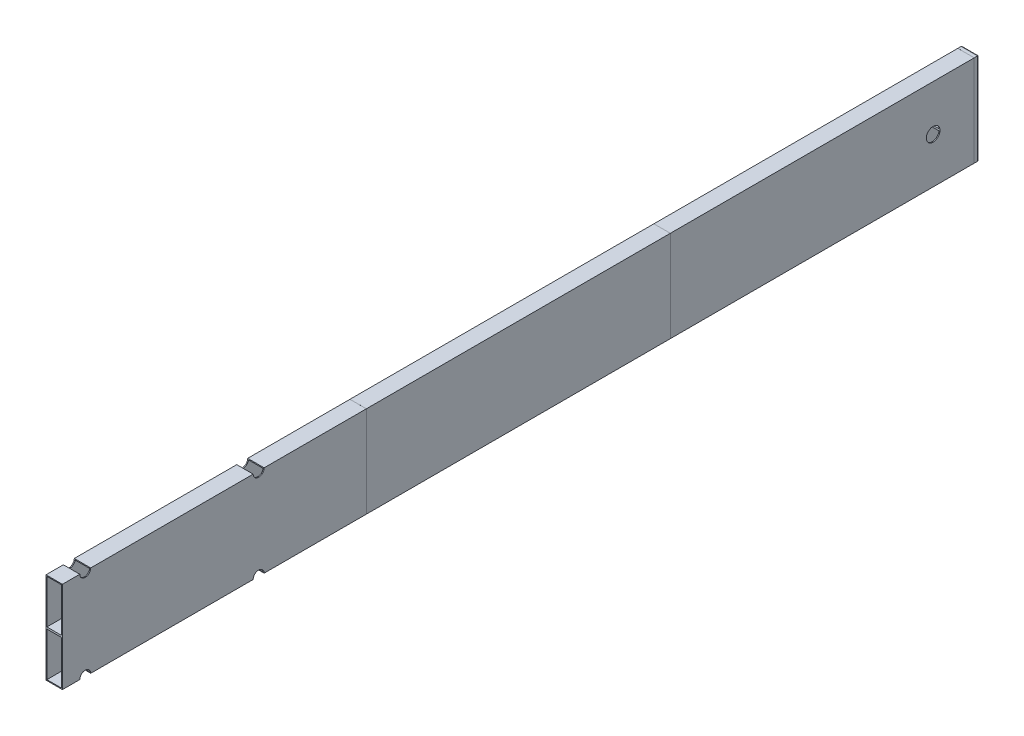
SolidWorks part; units mm, degrees
ref_plane "Plan1" through (0, 0, 0) normal (0, 0, 1) x (1, 0, 0)
ref_plane "Plan2" through (0, 0, 0) normal (0, 1, 0) x (1, 0, 0)
ref_plane "Plan3" through (0, 0, 0) normal (1, 0, 0) x (0, 0, -1)
sketch "Esquisse1" plane through (0, 0, 0) normal (0, 0, 1) x (1, 0, 0)
  line L0 (0, 0) -> (0, 110) construction
  line L1 (-9, 100) -> (9, 100)
  line L2 (-9, 100) -> (-9, 0)
  line L3 (-9, 0) -> (9, 0)
  line L4 (9, 100) -> (9, 0)
  line L5 (-9, 50) -> (30, 50) construction
  line L6 (-8, 49) -> (8, 49)
  line L7 (-8, 99) -> (8, 99)
  line L8 (-8, 99) -> (-8, 51)
  line L9 (-8, 51) -> (8, 51)
  line L10 (8, 99) -> (8, 51)
  line L11 (8, 1) -> (8, 49)
  line L12 (-8, 1) -> (-8, 49)
  line L13 (-8, 1) -> (8, 1)
  point P4 (0, 0)
  dimension "D1" = 100
  dimension "D2" = 18
  dimension "D3" = 16
  dimension "D4" = 48
  dimension "D5" = 1
extrude "Base-Extrusion" add sketch "Esquisse1" against normal blind 333
sketch "Esquisse4" plane through (9, 0, 0) normal (1, 0, 0) x (0, 0, -1)
  line L0 (333, 100) -> (0, 100) construction
  line L1 (333, 0) -> (0, 0) construction
  line L2 (0, 0) -> (0, 100) construction
  circle A0 centre (25, 100) radius 6
  circle A1 centre (215, 100) radius 6
  circle A2 centre (25, 0) radius 6
  circle A3 centre (215, 0) radius 6
  dimension "D1" = 12
  dimension "D2" = 12
  dimension "D3" = 12
  dimension "D4" = 12
  dimension "D6" = 190
  dimension "D5" = 25
extrude "Enlèv. mat.-Extru.1" cut sketch "Esquisse4" against normal through all
sketch "Esquisse7" plane through (0, 0, -333) normal (0, 0, -1) x (-1, 0, 0)
  line L0 (-9, 50) -> (20, 50) construction
  line L1 (-9, 0) -> (-9, 100) construction
  line L2 (0, 0) -> (0, 110) construction
  line L3 (-8, 1) -> (8, 1)
  line L4 (-8, 51) -> (8, 51)
  line L5 (-8, 51) -> (-8, 99)
  line L6 (-8, 99) -> (8, 99)
  line L7 (8, 51) -> (8, 99)
  line L8 (8, 49) -> (8, 1)
  line L9 (-8, 49) -> (8, 49)
  line L10 (-8, 49) -> (-8, 1)
  line L12 (-9.01, 100.01) -> (9.01, 100.01)
  line L13 (-9.01, 100.01) -> (-9.01, -0.01)
  line L14 (-9.01, -0.01) -> (9.01, -0.01)
  line L15 (9.01, 100.01) -> (9.01, -0.01)
  dimension "D1" = 18.02
  dimension "D2" = 100.02
extrude "Boss.-Extru.1" add sketch "Esquisse7" along normal blind 333
sketch "Esquisse8" plane through (0, 0, -666) normal (0, 0, -1) x (-1, 0, 0)
  line L0 (-9.01, 50) -> (20, 50) construction
  line L1 (-9.01, 100.01) -> (-9.01, -0.01) construction
  line L2 (0, 0) -> (0, 110) construction
  line L3 (-8, 1) -> (8, 1)
  line L4 (-8, 51) -> (8, 51)
  line L5 (-8, 51) -> (-8, 99)
  line L6 (-8, 99) -> (8, 99)
  line L7 (8, 51) -> (8, 99)
  line L8 (8, 49) -> (8, 1)
  line L9 (-8, 49) -> (8, 49)
  line L10 (-8, 49) -> (-8, 1)
  line L12 (-9, 100) -> (9, 100)
  line L13 (-9, 100) -> (-9, 0)
  line L14 (-9, 0) -> (9, 0)
  line L15 (9, 100) -> (9, 0)
  dimension "D1" = 18
  dimension "D2" = 100
extrude "Boss.-Extru.2" add sketch "Esquisse8" along normal blind 333
sketch "Esquisse9" plane through (0, 0, -999) normal (0, 0, -1) x (-1, 0, 0)
  line L0 (-9, 50) -> (20, 50) construction
  line L1 (-9.01, 100.01) -> (9.01, 100.01)
  line L2 (-9.01, 100.01) -> (-9.01, -0.01)
  line L3 (-9.01, -0.01) -> (9.01, -0.01)
  line L4 (9.01, 100.01) -> (9.01, -0.01)
  line L5 (-9, 100) -> (-9, 0) construction
  line L6 (0, 0) -> (0, 50) construction
  dimension "D1" = 100.02
  dimension "D2" = 18.02
extrude "Boss.-Extru.3" add sketch "Esquisse9" along normal blind 5
fillet "Congé1" radius 1.5
sketch "Esquisse10" plane through (9.01, 0, 0) normal (1, 0, 0) x (0, 0, -1)
  line L0 (165, 50) -> (999, 50) construction
  line L1 (999, 100.01) -> (999, -0.01) construction
sketch "Esquisse11" plane through (9, 0, 0) normal (1, 0, 0) x (0, 0, -1)
  line L0 (999, 0) -> (666, 0) construction
  line L1 (1004, 98.51) -> (1004, 1.49) construction
  circle A0 centre (954, 50) radius 7.5
  dimension "D1" = 15
  dimension "D2" = 50
  dimension "D3" = 50
extrude "Enlèv. mat.-Extru.2" cut sketch "Esquisse11" against normal through all
